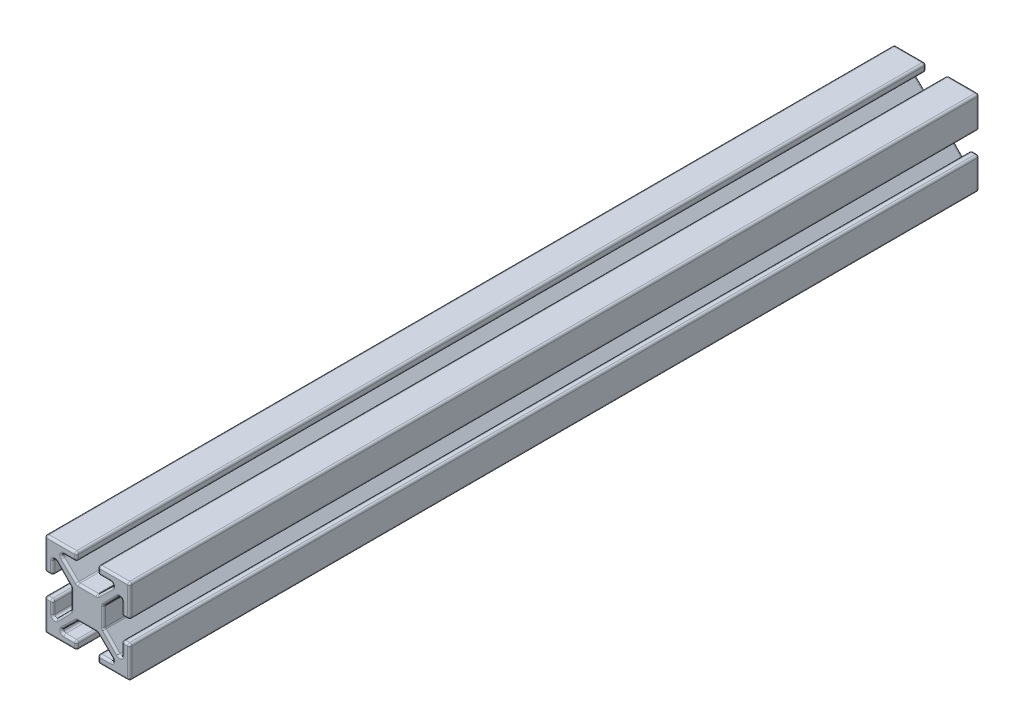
SolidWorks part; units mm, degrees
ref_plane "Front Plane" through (0, 0, 0) normal (0, 0, 1) x (1, 0, 0)
ref_plane "Top Plane" through (0, 0, 0) normal (0, 1, 0) x (1, 0, 0)
ref_plane "Right Plane" through (0, 0, 0) normal (1, 0, 0) x (0, 0, -1)
sketch "Sketch1" plane through (0, 0, 0) normal (0, 0, 1) x (1, 0, 0)
  line L0 (-5, 20) -> (-5, 16.2126)
  line L1 (-20, -20) -> (20, -20)
  line L2 (-20, -20) -> (-20, 20)
  line L3 (-20, 20) -> (20, 20)
  line L4 (20, -20) -> (20, 20)
  line L5 (-20, -20) -> (20, 20) construction
  line L6 (-20, 20) -> (20, -20) construction
  line L7 (-5, 16.2126) -> (-13.4323, 16.2126)
  line L8 (-13.4323, 16.2126) -> (-4.6312, 7.6894)
  line L9 (-4.6312, 7.6894) -> (0, 7.6894)
  line L10 (-7.6894, 4.6312) -> (-7.6894, 0)
  line L11 (-16.2126, 13.4323) -> (-7.6894, 4.6312)
  line L12 (-16.2126, 5) -> (-16.2126, 13.4323)
  line L13 (-20, 5) -> (-16.2126, 5)
  line L14 (0, 7.6894) -> (0, 16.8611) construction
  line L15 (0, 0) -> (-11.384, 0) construction
  line L16 (5, 20) -> (5, 16.2126)
  line L17 (5, 16.2126) -> (13.4323, 16.2126)
  line L18 (13.4323, 16.2126) -> (4.6312, 7.6894)
  line L19 (16.2126, 13.4323) -> (7.6894, 4.6312)
  line L20 (16.2126, 5) -> (16.2126, 13.4323)
  line L21 (20, 5) -> (16.2126, 5)
  line L22 (7.6894, 4.6312) -> (7.6894, 0)
  line L23 (4.6312, 7.6894) -> (0, 7.6894)
  line L24 (20, -5) -> (16.2126, -5)
  line L25 (16.2126, -5) -> (16.2126, -13.4323)
  line L26 (16.2126, -13.4323) -> (7.6894, -4.6312)
  line L27 (13.4323, -16.2126) -> (4.6312, -7.6894)
  line L28 (5, -16.2126) -> (13.4323, -16.2126)
  line L29 (5, -20) -> (5, -16.2126)
  line L30 (4.6312, -7.6894) -> (0, -7.6894)
  line L31 (7.6894, -4.6312) -> (7.6894, 0)
  line L32 (-5, -20) -> (-5, -16.2126)
  line L33 (-5, -16.2126) -> (-13.4323, -16.2126)
  line L34 (-13.4323, -16.2126) -> (-4.6312, -7.6894)
  line L35 (-16.2126, -13.4323) -> (-7.6894, -4.6312)
  line L36 (-16.2126, -5) -> (-16.2126, -13.4323)
  line L37 (-20, -5) -> (-16.2126, -5)
  line L38 (-7.6894, -4.6312) -> (-7.6894, 0)
  line L39 (-4.6312, -7.6894) -> (0, -7.6894)
  point P0 (0, 0)
  point P52 (0, 0)
  dimension "D1" = 40
  dimension "D2" = 40
  dimension "D4" = 15
  dimension "D3" = 4
extrude "Boss-Extrude1" add sketch "Sketch1" along normal blind 400 contours L34 L39 L30 L27 L28 L29 L1 L4 L24 L25 L26 L31 L22 L19 L20 L21 L3 L16 L17 L18 L23 L9 L8 L7 L0 L2 L13 L12 L11 L10 L38 L35 L36 L37 L32 L33
fillet "Fillet3" radius 1 108 edges at (-9.0317, -11.951, 0) (0, -7.6894, 0) (9.0317, -11.951, 0) (9.2161, -16.2126, 0) (5, -18.1063, 0) (12.5, -20, 0) (20, -12.5, 0) (18.1063, -5, 0) (16.2126, -9.2161, 0) (11.951, -9.0317, 0) (7.6894, 0, 0) (11.951, 9.0317, 0) (16.2126, 9.2161, 0) (18.1063, 5, 0) (20, 12.5, 0) (5, 18.1063, 0) (9.2161, 16.2126, 0) (9.0317, 11.951, 0) (0, 7.6894, 0) (-9.0317, 11.951, 0) (-9.2161, 16.2126, 0) (-5, 18.1063, 0) (-12.5, 20, 0) (-20, 12.5, 0) (-18.1063, 5, 0) (-16.2126, 9.2161, 0) (-11.951, 9.0317, 0) (-7.6894, 0, 0) (-11.951, -9.0317, 0) (-16.2126, -9.2161, 0) (-18.1063, -5, 0) (-20, -12.5, 0) (-12.5, -20, 0) (-5, -18.1063, 0) (-9.2161, -16.2126, 0) (-9.0317, -11.951, 400) (0, -7.6894, 400) (9.0317, -11.951, 400) (9.2161, -16.2126, 400) (5, -18.1063, 400) (12.5, -20, 400) (20, -12.5, 400) (18.1063, -5, 400) (16.2126, -9.2161, 400) (11.951, -9.0317, 400) (7.6894, 0, 400) (11.951, 9.0317, 400) (16.2126, 9.2161, 400) (18.1063, 5, 400) (20, 12.5, 400) (12.5, 20, 400) (5, 18.1063, 400) (9.2161, 16.2126, 400) (9.0317, 11.951, 400) (0, 7.6894, 400) (-9.0317, 11.951, 400) (-9.2161, 16.2126, 400) (-5, 18.1063, 400) (-12.5, 20, 400) (-20, 12.5, 400) (-18.1063, 5, 400) (-16.2126, 9.2161, 400) (-11.951, 9.0317, 400) (-7.6894, 0, 400) (-11.951, -9.0317, 400) (-16.2126, -9.2161, 400) (-18.1063, -5, 400) (-20, -12.5, 400) (-12.5, -20, 400) (-5, -18.1063, 400) (-9.2161, -16.2126, 400) (-13.4323, -16.2126, 200) (-5, -16.2126, 200) (-5, -20, 200) (-20, -20, 200) (-20, -5, 200) (-16.2126, -5, 200) (-16.2126, -13.4323, 200) (-7.6894, -4.6312, 200) (-7.6894, 4.6312, 200) (-16.2126, 13.4323, 200) (-16.2126, 5, 200) (-20, 5, 200) (-20, 20, 200) (-5, 20, 200) (-5, 16.2126, 200) (-13.4323, 16.2126, 200) (-4.6312, 7.6894, 200) (4.6312, 7.6894, 200) (13.4323, 16.2126, 200) (5, 16.2126, 200) (5, 20, 200) (20, 20, 200) (20, 5, 200) (16.2126, 5, 200) (16.2126, 13.4323, 200) (7.6894, 4.6312, 200) (7.6894, -4.6312, 200) (16.2126, -13.4323, 200) (16.2126, -5, 200) (20, -5, 200) (20, -20, 200) (5, -20, 200) (5, -16.2126, 200) (13.4323, -16.2126, 200) (4.6312, -7.6894, 200) (-4.6312, -7.6894, 200) (12.5, 20, 0)
ref_plane "Plane1" through (0, 0, 200) normal (0, 0, 1) x (1, 0, 0)
